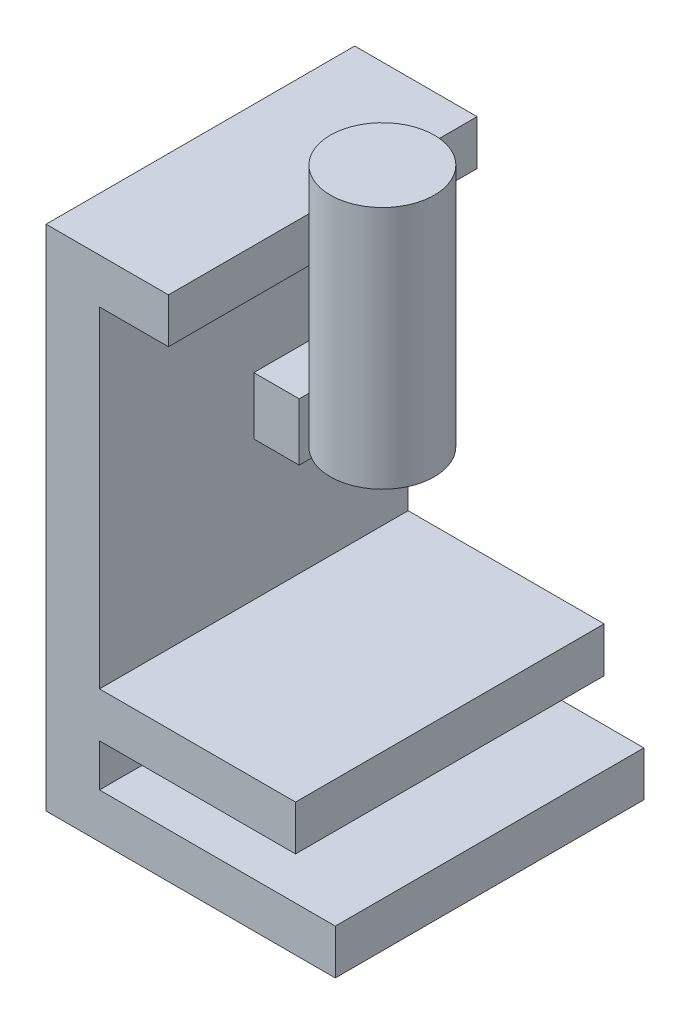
SolidWorks part; units mm, degrees
ref_plane "Front" through (0, 0, 0) normal (0, 0, 1) x (1, 0, 0)
ref_plane "Top" through (0, 0, 0) normal (0, 1, 0) x (1, 0, 0)
ref_plane "Right" through (0, 0, 0) normal (1, 0, 0) x (0, 0, -1)
sketch "Sketch1" plane through (8.5643, -28.3878, 0) normal (0, 0, 1) x (0, 1, 0)
  line L0 (-58.1634, -54.4213) -> (98.2773, -54.4213)
  line L1 (-31.2198, -131.2019) -> (-17.3789, -131.2019)
  line L2 (-17.3789, -131.2019) -> (-17.3789, -70.8632)
  line L4 (98.2773, -54.4213) -> (98.2773, -92.0903)
  line L6 (-58.1634, -143.4403) -> (-58.1634, -54.4213)
  line L16 (-131.7247, -54.4213) -> (174.6253, -54.4213) construction
  line L17 (-17.3789, -70.8632) -> (25.4963, -70.8632)
  line L18 (43.1793, -70.8632) -> (84.4364, -70.8632)
  line L19 (43.1793, -84.8357) -> (43.1793, -70.8632)
  line L20 (25.4963, -84.8357) -> (43.1793, -84.8357)
  line L21 (25.4963, -70.8632) -> (25.4963, -84.8357)
  line L24 (-31.2198, -70.8632) -> (-31.2198, -131.2019)
  line L25 (-58.1634, -143.4403) -> (-44.3225, -143.4403)
  line L26 (84.4364, -92.0903) -> (98.2773, -92.0903)
  line L27 (84.4364, -70.8632) -> (84.4364, -92.0903)
  line L28 (-44.3225, -70.8632) -> (-31.2198, -70.8632)
  line L29 (-44.3225, -143.4403) -> (-44.3225, -70.8632)
extrude "Extrude1" add sketch "Sketch1" along normal mid plane 95
ref_plane "Plane1" through (0, 79.8894, 0) normal (0, 1, 0) x (-1, 0, 0)
sketch "Sketch3" plane through (0, 14.7915, 0) normal (0, 1, 0) x (-1, 0, 0)
  line L0 (-79.4274, 0) -> (-93.3999, 0)
  line L4 (-93.3999, -47.5) -> (-79.4274, -47.5)
  line L5 (-79.4274, -47.5) -> (-79.4274, 47.5)
  line L6 (-79.4274, 47.5) -> (-93.3999, 47.5)
  line L7 (-93.3999, 47.5) -> (-93.3999, -47.5)
  line L9 (-79.4274, 0) -> (-79.4274, 47.5)
  line L10 (-79.4274, 47.5) -> (-93.3999, 47.5)
  line L11 (-93.3999, 47.5) -> (-93.3999, 0)
  dimension "D1" = 0
extrude "Cut-Extrude1" cut sketch "Sketch3" against normal up to next
sketch "Sketch2" plane through (0, 79.8894, 0) normal (0, 1, 0) x (-1, 0, 0)
  circle A0 centre (-118.9971, 0) radius 15.9977
extrude "Boss-Extrude1" add sketch "Sketch2" against normal up to vertex (65.098 mm away) from offset 10 separate body
